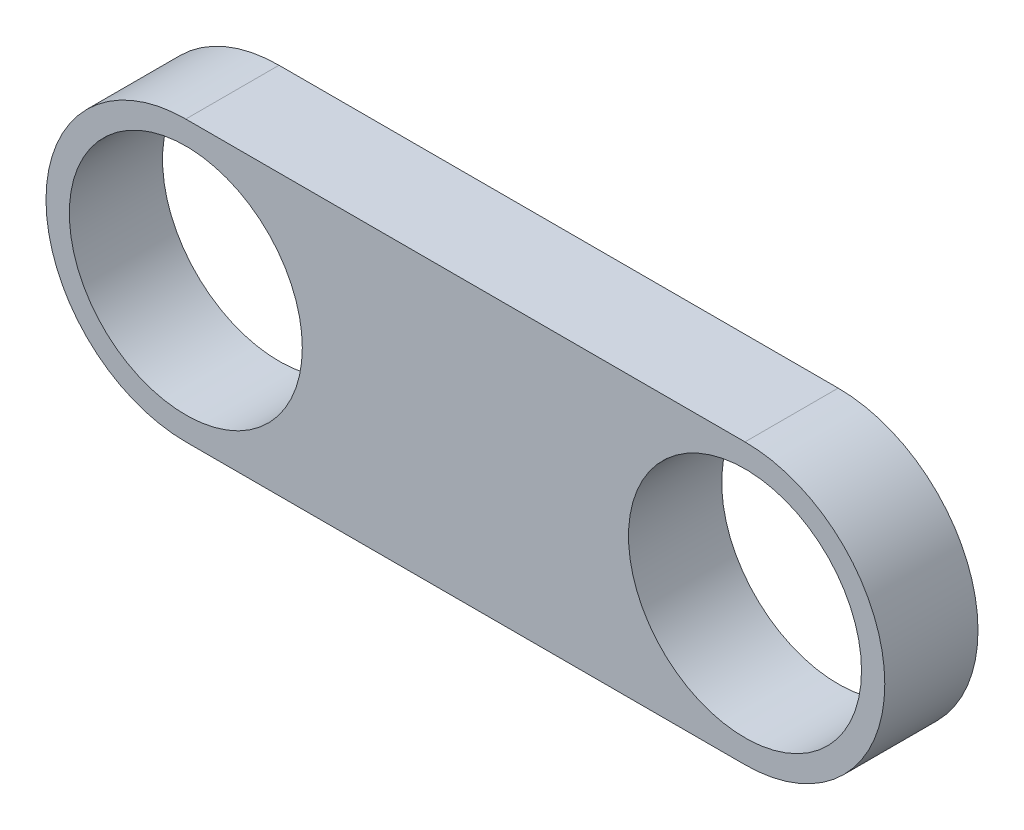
SolidWorks part; units mm, degrees
ref_plane "Front Plane" through (0, 0, 0) normal (0, 0, 1) x (1, 0, 0)
ref_plane "Top Plane" through (0, 0, 0) normal (0, 1, 0) x (1, 0, 0)
ref_plane "Right Plane" through (0, 0, 0) normal (1, 0, 0) x (0, 0, -1)
sketch "Sketch1" plane through (0, 0, 0) normal (0, 0, 1) x (1, 0, 0)
  line L0 (0, 0) -> (60, 0) construction
  line L1 (0, 15) -> (60, 15)
  line L2 (0, -15) -> (60, -15)
  arc A0 (0, 15) -> (0, -15) centre (0, 0) ccw
  arc A1 (60, -15) -> (60, 15) centre (60, 0) ccw
  circle A2 centre (0, 0) radius 12.5
  circle A3 centre (60, 0) radius 12.5
  point P3 (30, 0)
  dimension "D1" = 15
  dimension "D2" = 60
  dimension "D3" = 25
  dimension "D4" = 25
extrude "Boss-Extrude1" add sketch "Sketch1" along normal blind 10
